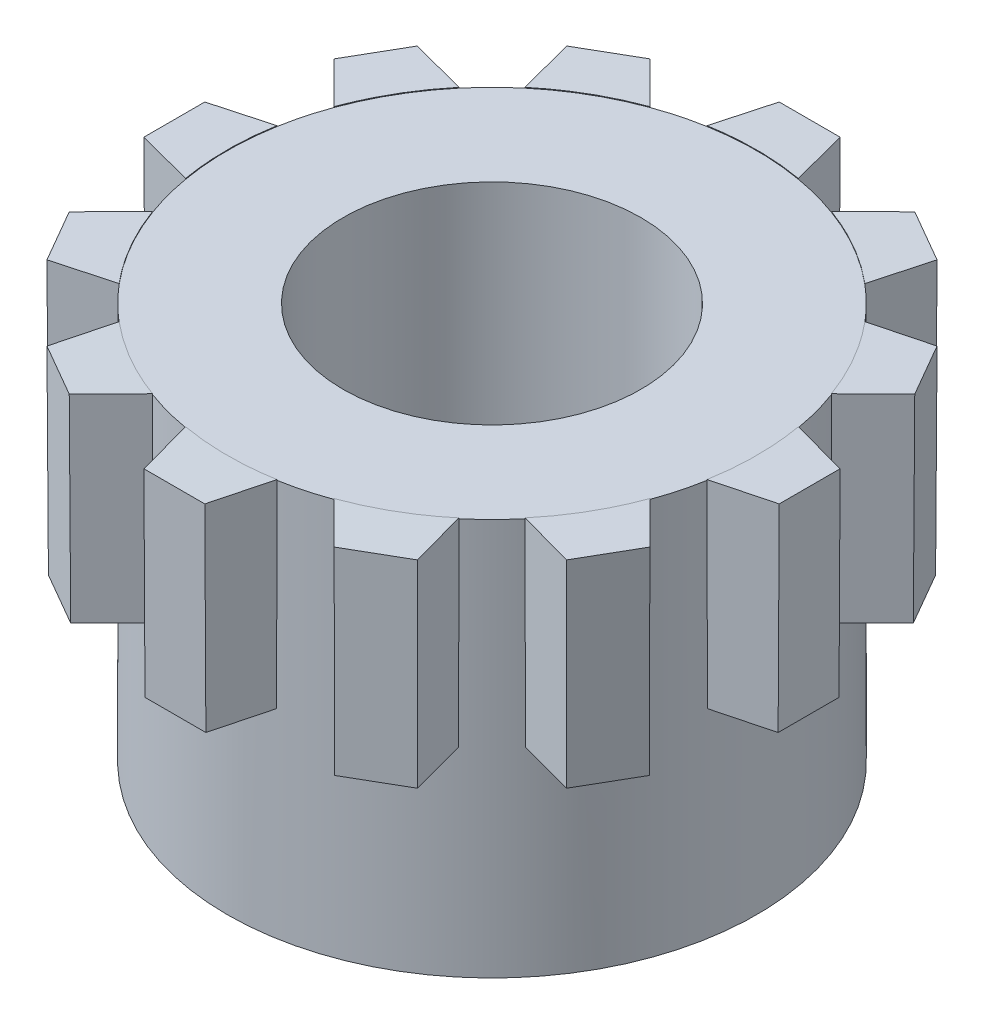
SolidWorks part; units mm, degrees
ref_plane "Front Plane" through (0, 0, 0) normal (0, 0, 1) x (1, 0, 0)
ref_plane "Top Plane" through (0, 0, 0) normal (0, 1, 0) x (1, 0, 0)
ref_plane "Right Plane" through (0, 0, 0) normal (1, 0, 0) x (0, 0, -1)
sketch "Sketch1" plane through (0, 0, 0) normal (0, 0, 1) x (1, 0, 0)
  line L0 (0, 0) -> (0, 13.7365) construction
  line L1 (0, 3.81) -> (7.7201, 3.81) construction
  line L2 (2.8575, 7.62) -> (2.8575, 0)
  line L3 (2.8575, 7.62) -> (5.08, 7.62)
  line L4 (2.8575, 0) -> (5.08, 0)
  line L5 (5.08, 7.62) -> (5.08, 0)
  point P8 (2.8575, 3.81)
  point P11 (5.08, 3.81)
  dimension "D1" = 7.62
  dimension "D2" = 5.08
  dimension "D3" = 5.715
revolve "Revolve1" add sketch "Sketch1" angle 360 about L0
ref_plane "Plane1" through (0, 3.81, 0) normal (0, 1, 0) x (-1, 0, 0)
sketch "Sketch2" plane through (0, 0, 0) normal (0, 0, 1) x (1, 0, 0)
  line L0 (7.5994, 3.81) -> (7.62, 7.62) construction
  line L1 (8.382, 3.81) -> (-8.382, 3.81) construction
ref_plane "Plane2" through (7.62, 7.62, 0) normal (0.0054, 1, 0) x (-1, 0.0054, 0)
sketch "Sketch3" plane through (7.62, 7.62, 0) normal (0.0054, 1, 0) x (-1, 0.0054, 0)
  line L0 (7.5787, 0) -> (-2.6994, 0) construction
  line L1 (2.6162, -0.8769) -> (1.524, -0.5842)
  line L2 (2.6162, 0.8769) -> (1.524, 0.5842)
  line L3 (1.524, -0.5842) -> (1.524, 0.5842)
  ellipse E0 centre (7.6199, 0) end of major axis (7.6199, 5.08) minor radius 5.0799 construction
  ellipse E1 centre (7.6199, 0) end of major axis (7.6199, 5.08) minor radius 5.0799 (2.6162, 0.8769) -> (2.6162, -0.8769) ccw
  point P8 (1.524, 0)
  dimension "D1" = 30
  dimension "D2" = 1.016
  dimension "D3" = 1.1684
extrude "Extrude1" add sketch "Sketch3" against normal blind 3.81 contours E1 L0 L3 L1 | L0 E1 L2 L3
pattern_circular "CirPattern1" count 12 over 360 about axis through (0, 0, 0) along (0, 1, 0) of "Extrude1"
